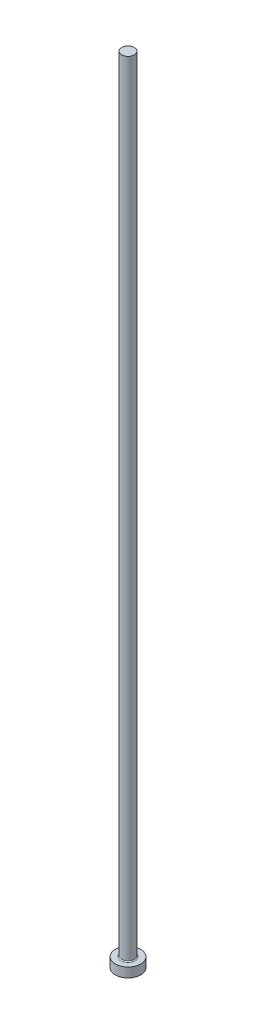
SolidWorks part; units mm, degrees
ref_plane "Plano frontal" through (0, 0, 0) normal (0, 0, 1) x (1, 0, 0)
ref_plane "Plano superior" through (0, 0, 0) normal (0, 1, 0) x (1, 0, 0)
ref_plane "Plano direito" through (0, 0, 0) normal (1, 0, 0) x (0, 0, -1)
sketch "Esboço1" plane through (0, 0, 0) normal (0, 0, 1) x (1, 0, 0)
  line L0 (0, 0) -> (4, 0)
  line L1 (4, 0) -> (4, 3)
  line L2 (4, 3) -> (2.3, 3)
  line L3 (2, 3.3) -> (2, 250)
  line L4 (2, 250) -> (0, 250)
  line L5 (0, 250) -> (0, 0) construction
  line L6 (0, 0) -> (0, 250)
  arc A0 (2.3, 3) -> (2, 3.3) centre (2.3, 3.3) cw
  dimension "D3" = 0.3
  dimension "D1" = 8
  dimension "D2" = 4
  dimension "D4" = 3
  dimension "D5" = 250
revolve "Revolução1" add sketch "Esboço1" angle 360 about L5
sketch "Esboço2"
  dimension "D1" = 0.45
  dimension "D2" = 0.7
  dimension "D3" = 0.3
  dimension "D4" = 2.15
wrap "Envolver1" sketch "Esboço2" wrap type deboss source sketch "Esboço2" thickness 0.1 parameters "D1"=0.1
